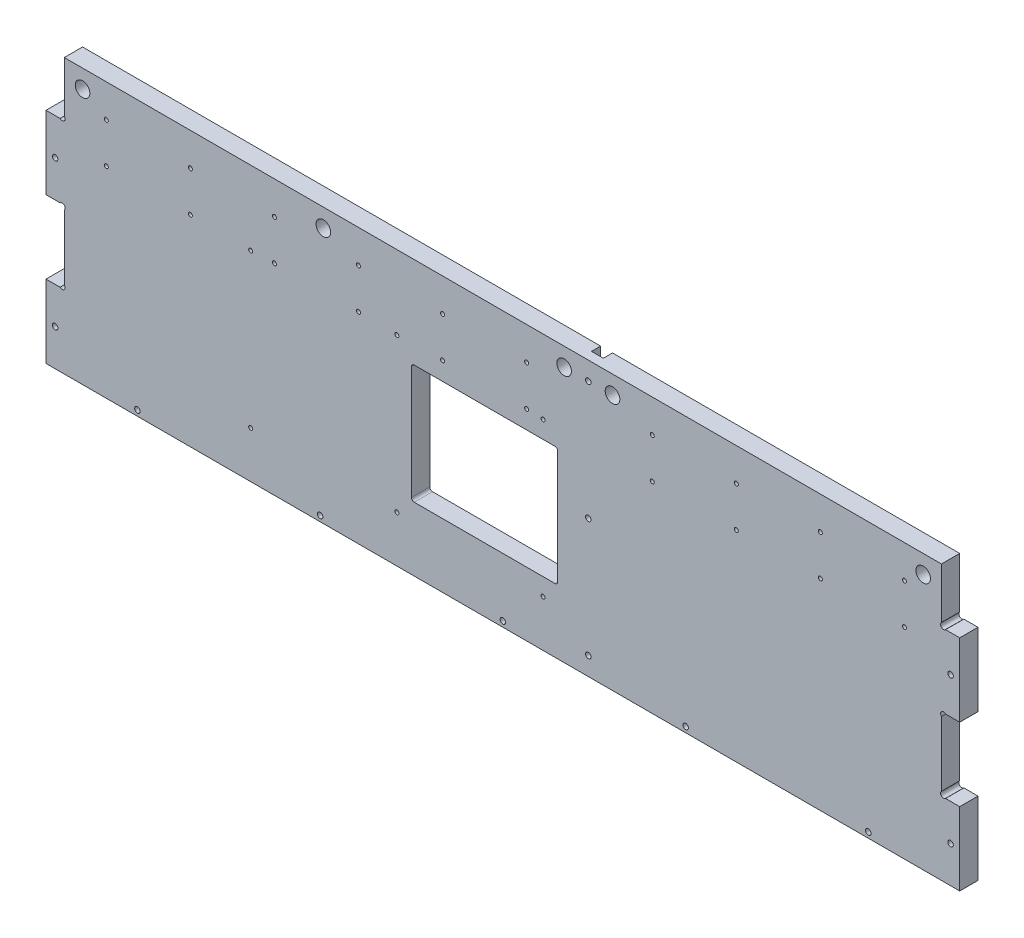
SolidWorks part; units mm, degrees
ref_plane "Plan de face" through (0, 0, 0) normal (0, 0, 1) x (1, 0, 0)
ref_plane "Plan de dessus" through (0, 0, 0) normal (0, 1, 0) x (1, 0, 0)
ref_plane "Plan de droite" through (0, 0, 0) normal (1, 0, 0) x (0, 0, -1)
sketch "Esquisse1" plane through (0, 0, 0) normal (0, 0, 1) x (1, 0, 0)
  line L0 (0, 0) -> (500, 0)
  line L2 (275, 0) -> (-275, 0) construction
  line L4 (0, -82.5) -> (0, 82.5) construction
  line L5 (500, 0) -> (500, 40)
  line L6 (500, 40) -> (490, 40)
  line L7 (490, 40) -> (490, 80)
  line L8 (490, 80) -> (500, 80)
  line L9 (500, 80) -> (500, 120)
  line L10 (500, 120) -> (490, 120)
  line L11 (490, 120) -> (490, 150)
  line L12 (490, 150) -> (10, 150)
  line L13 (10, 150) -> (10, 120)
  line L14 (10, 120) -> (0, 120)
  line L15 (0, 120) -> (0, 80)
  line L16 (0, 80) -> (10, 80)
  line L17 (10, 80) -> (10, 40)
  line L18 (10, 40) -> (0, 40)
  line L19 (0, 40) -> (0, 0)
  dimension "D1" = 40
  dimension "D2" = 10
  dimension "D3" = 500
  dimension "D4" = 150
extrude "Extrusion1" add sketch "Esquisse1" along normal blind 10
sketch "Esquisse2" plane through (0, 0, 10) normal (0, 0, 1) x (1, 0, 0)
  line L0 (250, 0) -> (250, 150) construction
  line L1 (0, 0) -> (500, 0) construction
  line L2 (490, 150) -> (10, 150) construction
  line L3 (10, 40) -> (-2.4055, 52.4055) construction
  line L4 (10, 40) -> (0, 40) construction
  line L5 (10, 80) -> (10, 40) construction
  line L6 (10, 80) -> (-2.4762, 67.5238) construction
  line L7 (0, 80) -> (10, 80) construction
  line L8 (10, 120) -> (-2.4762, 132.4762) construction
  line L9 (10, 120) -> (0, 120) construction
  line L10 (10, 150) -> (10, 120) construction
  line L11 (490, 40) -> (495.9282, 45.9282) construction
  line L12 (500, 40) -> (490, 40) construction
  circle A0 centre (8.8686, 121.1314) radius 1.6
  circle A1 centre (8.8686, 78.8686) radius 1.6
  circle A2 centre (8.8686, 41.1314) radius 1.6
  circle A3 centre (491.1314, 121.1314) radius 1.6
  circle A4 centre (491.1314, 78.8686) radius 1.6
  circle A5 centre (491.1314, 41.1314) radius 1.6
  dimension "D1" = 3.2
extrude "Enlèv. mat.-enfourchement" cut sketch "Esquisse2" against normal through all
sketch "Esquisse3" plane through (0, 0, 10) normal (0, 0, 1) x (1, 0, 0)
  line L0 (500, 3) -> (0, 3) construction
  line L3 (500, 0) -> (500, 40) construction
  line L4 (250, 0) -> (250, 150) construction
  line L5 (0, 0) -> (500, 0) construction
  line L6 (490, 150) -> (10, 150) construction
  line L7 (495, 120) -> (495, 0) construction
  line L8 (500, 120) -> (492.2627, 120) construction
  line L9 (500, 80) -> (500, 120) construction
  line L10 (0, 40) -> (0, 0) construction
  line L11 (5, 0) -> (5, 120) construction
  line L12 (7.7373, 120) -> (0, 120) construction
  line L13 (0, 120) -> (0, 80) construction
  line L14 (0, 100) -> (500, 100) construction
  line L15 (500, 20) -> (0, 20) construction
  line L16 (450, 0) -> (450, 34.5114) construction
  line L17 (350, 0) -> (350, 34.5114) construction
  line L18 (150, 0) -> (150, 34.5114) construction
  line L19 (50, 0) -> (50, 28.3814) construction
  circle A0 centre (5, 20) radius 1.5
  circle A1 centre (5, 100) radius 1.5
  circle A2 centre (495, 20) radius 1.5
  circle A3 centre (495, 100) radius 1.5
  circle A4 centre (250, 3) radius 1.5
  circle A5 centre (50, 3) radius 1.5
  circle A6 centre (150, 3) radius 1.5
  circle A7 centre (450, 3) radius 1.5
  circle A8 centre (350, 3) radius 1.5
  dimension "D8" = 3
  dimension "D1" = 5
  dimension "D2" = 3
  dimension "D3" = 5
  dimension "D4" = 100
  dimension "D5" = 100
  dimension "D6" = 100
  dimension "D7" = 100
extrude "Enlèv. mat.-fixation sol et murs" cut sketch "Esquisse3" against normal through all
sketch "Esquisse5" plane through (0, 0, 10) normal (0, 0, 1) x (1, 0, 0)
  line L0 (0, 120) -> (0, 80) construction
  line L1 (201.5, 35) -> (278.5, 35)
  line L2 (200, 36.5) -> (200, 98.5)
  line L3 (201.5, 100) -> (278.5, 100)
  line L4 (280, 36.5) -> (280, 98.5)
  line L6 (0, 0) -> (500, 0) construction
  arc A0 (201.5, 100) -> (200, 98.5) centre (201.5, 98.5) ccw
  arc A1 (200, 36.5) -> (201.5, 35) centre (201.5, 36.5) ccw
  arc A2 (280, 36.5) -> (278.5, 35) centre (278.5, 36.5) cw
  arc A3 (280, 98.5) -> (278.5, 100) centre (278.5, 98.5) ccw
  point P8 (200, 100)
  point P15 (280, 100)
  dimension "D3" = 1.5
  dimension "D1" = 200
  dimension "D2" = 80
  dimension "D4" = 35
  dimension "D5" = 65
extrude "Enlèv. mat.-fenetre" cut sketch "Esquisse5" against normal through all
sketch "Esquisse6" plane through (0, 0, 0) normal (0, 0, -1) x (-1, 0, 0)
  line L0 (-490, 150) -> (-10, 150) construction
  line L1 (-293.5, 150) -> (-300, 150)
  line L2 (-293.5, 150) -> (-293.5, 0)
  line L3 (-293.5, 0) -> (-300, 0)
  line L4 (-300, 150) -> (-300, 0)
  line L5 (0, 0) -> (-500, 0) construction
  line L7 (0, 120) -> (0, 80) construction
  dimension "D1" = 300
  dimension "D2" = 6.5
extrude "Enlèv. mat.-Encastrement" cut sketch "Esquisse6" against normal blind 5
sketch "Esquisse4" plane through (0, 0, 10) normal (0, 0, 1) x (1, 0, 0)
  line L0 (10, 140) -> (490, 140) construction
  line L1 (10, 150) -> (10, 122.2627) construction
  line L2 (490, 122.2627) -> (490, 150) construction
  line L3 (490, 150) -> (10, 150) construction
  line L4 (250, 150) -> (250, 116.5383) construction
  line L5 (300, 150) -> (300, 0) construction
  line L6 (293.5, 0) -> (293.5, 150) construction
  circle A0 centre (480, 140) radius 4
  circle A1 centre (20, 140) radius 4
  circle A2 centre (310, 140) radius 4
  circle A3 centre (283.5, 140) radius 4
  circle A4 centre (151.75, 140) radius 4
  dimension "D2" = 8
  dimension "D3" = 10
  dimension "D5" = 10
  dimension "D1" = 10
  dimension "D4" = 10
  dimension "D6" = 131.75
extrude "Enlèv. mat.-Extru.1" cut sketch "Esquisse4" against normal through all
sketch "Esquisse7" plane through (0, 0, 5) normal (0, 0, -1) x (-1, 0, 0)
  line L0 (-310, 140) -> (-283.5, 140) construction
  line L1 (-296.75, 150) -> (-296.75, 0) construction
  line L2 (-293.5, 150) -> (-300, 150) construction
  line L3 (-300, 0) -> (-293.5, 0) construction
  line L4 (-293.5, 75) -> (-300, 75) construction
  line L5 (-293.5, 0) -> (-293.5, 150) construction
  line L6 (-300, 150) -> (-300, 0) construction
  circle A0 centre (-296.75, 140) radius 1.5
  circle A1 centre (-296.75, 75) radius 1.5
  circle A2 centre (-296.75, 10) radius 1.5
  dimension "D1" = 3
  dimension "D2" = 10
extrude "Enlèv. mat.-Fixation encastrement" cut sketch "Esquisse7" against normal through all
sketch "Esquisse8" plane through (0, 0, 0) normal (0, 0, -1) x (-1, 0, 0)
  line L0 (-33.6663, 132) -> (-471.7393, 132) construction
  line L1 (-490, 150) -> (-300, 150) construction
  line L2 (-20, 110) -> (-480, 110) construction
  line L3 (-278.5, 100) -> (-201.5, 100) construction
  line L4 (-240, 35) -> (-240, 157.2908) construction
  line L5 (-201.5, 35) -> (-278.5, 35) construction
  line L6 (-263, 132) -> (-263, 110) construction
  line L7 (-217, 110) -> (-217, 132) construction
  line L9 (-33, 110) -> (-33, 132) construction
  line L10 (-171, 110) -> (-171, 132) construction
  line L11 (-125, 110) -> (-125, 132) construction
  line L12 (-79, 110) -> (-79, 132) construction
  line L14 (-293.5, 150) -> (-300, 150) construction
  line L15 (-469.75, 132) -> (-469.75, 110) construction
  line L24 (-377.75, 110) -> (-377.75, 132) construction
  line L25 (-423.75, 110) -> (-423.75, 132) construction
  line L27 (-331.75, 110) -> (-331.75, 132) construction
  circle A0 centre (-263, 132) radius 1.1
  circle A1 centre (-217, 132) radius 1.1
  circle A2 centre (-263, 110) radius 1.1
  circle A3 centre (-217, 110) radius 1.1
  circle A4 centre (-171, 132) radius 1.1
  circle A5 centre (-171, 110) radius 1.1
  circle A8 centre (-125, 132) radius 1.1
  circle A9 centre (-125, 110) radius 1.1
  circle A10 centre (-33, 110) radius 1.1
  circle A11 centre (-33, 132) radius 1.1
  circle A12 centre (-79, 132) radius 1.1
  circle A13 centre (-79, 110) radius 1.1
  circle A35 centre (-377.75, 132) radius 1.1
  circle A37 centre (-423.75, 110) radius 1.1
  circle A41 centre (-423.75, 132) radius 1.1
  circle A43 centre (-377.75, 110) radius 1.1
  circle A46 centre (-469.75, 132) radius 1.1
  circle A47 centre (-469.75, 110) radius 1.1
  circle A48 centre (-331.75, 132) radius 1.1
  circle A49 centre (-331.75, 110) radius 1.1
  point P49 (-296.75, 150)
  dimension "D3" = 2.2
  dimension "D15" = 22
  dimension "D2" = 46
  dimension "D4" = 46
  dimension "D5" = 46
  dimension "D7" = 46
  dimension "D8" = 46
  dimension "D10" = 35
  dimension "D11" = 46
  dimension "D12" = 46
  dimension "D16" = 18
  dimension "D17" = 10
  dimension "D18" = 46
extrude "Enlèv. mat.-Tame" cut sketch "Esquisse8" against normal through all
sketch "Esquisse9" plane through (0, 0, 0) normal (0, 0, -1) x (-1, 0, 0)
  line L0 (-293.5, 109.5) -> (-104.1254, 109.5) construction
  line L1 (-293.5, 0) -> (-293.5, 150) construction
  line L2 (-293.5, 25.5) -> (-104.1254, 25.5) construction
  line L3 (-272, 110.7824) -> (-272, 25.2598) construction
  line L4 (-280, 36.5) -> (-280, 98.5) construction
  line L5 (-192, 110.7824) -> (-192, 25.2598) construction
  line L6 (-112, 110.7824) -> (-112, 25.2598) construction
  line L7 (-278.5, 100) -> (-201.5, 100) construction
  line L8 (-201.5, 35) -> (-278.5, 35) construction
  circle A0 centre (-272, 109.5) radius 1.1
  circle A1 centre (-192, 109.5) radius 1.1
  circle A2 centre (-112, 109.5) radius 1.1
  circle A3 centre (-112, 25.5) radius 1.1
  circle A4 centre (-192, 25.5) radius 1.1
  circle A5 centre (-272, 25.5) radius 1.1
  dimension "D6" = 2.2
  dimension "D1" = 8
  dimension "D2" = 80
  dimension "D3" = 80
  dimension "D4" = 9.5
  dimension "D5" = 9.5
extrude "Enlèv. mat.-fixation_glissiere" cut sketch "Esquisse9" against normal through all
